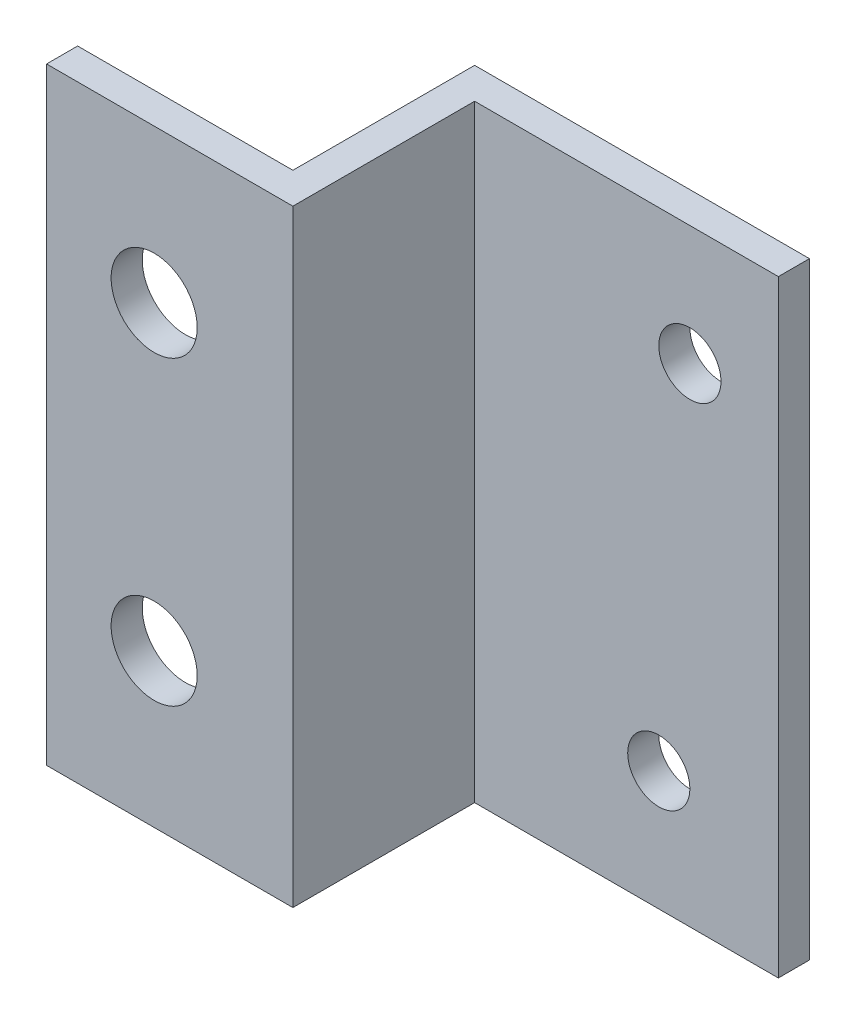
SolidWorks part; units mm, degrees
ref_plane "Front Plane" through (0, 0, 0) normal (0, 0, 1) x (1, 0, 0)
ref_plane "Top Plane" through (0, 0, 0) normal (0, 1, 0) x (1, 0, 0)
ref_plane "Right Plane" through (0, 0, 0) normal (1, 0, 0) x (0, 0, -1)
sketch "Sketch2" plane through (0, 0, 0) normal (0, 1, 0) x (1, 0, 0)
  line L1 (-51.5, 0) -> (0, 0)
  line L2 (-51.5, 0) -> (-51.5, 6.5)
  line L3 (-51.5, 6.5) -> (-6.5, 6.5)
  line L6 (0, 0) -> (0, 38)
  line L8 (-6.5, 6.5) -> (-6.5, 38)
  line L9 (-6.5, 44.5) -> (63.5, 44.5)
  line L10 (-6.5, 44.5) -> (-6.5, 38)
  line L11 (0, 38) -> (63.5, 38)
  line L12 (63.5, 44.5) -> (63.5, 38)
  point P11 (0, 0)
  dimension "D1" = 45
  dimension "D2" = 6.5
  dimension "D3" = 6.5
  dimension "D4" = 6.5
  dimension "D5" = 70
  dimension "D6" = 38
extrude "Boss-Extrude1" add sketch "Sketch2" along normal mid plane 127
sketch "Sketch3" plane through (0, 0, 0) normal (0, 0, 1) x (1, 0, 0)
  line L0 (-51.5, 63.5) -> (-51.5, -63.5) construction
  line L1 (-51.5, -63.5) -> (0, -63.5) construction
  line L2 (0, -63.5) -> (63.5, -63.5) construction
  line L3 (-29, 31.5) -> (-29, -31.5) construction
  line L4 (63.5, 63.5) -> (63.5, -63.5) construction
  circle A0 centre (-29, 31.5) radius 9
  circle A1 centre (-29, -31.5) radius 9
  circle A2 centre (45, 38.5) radius 6.5
  circle A3 centre (38.5, -38.5) radius 6.5
  dimension "D1" = 18
  dimension "D6" = 13
  dimension "D2" = 63
  dimension "D3" = 22.5
  dimension "D4" = 32
  dimension "D5" = 6.5
  dimension "D7" = 77
  dimension "D8" = 25
  dimension "D9" = 25
extrude "Cut-Extrude1" cut sketch "Sketch3" against normal through all
